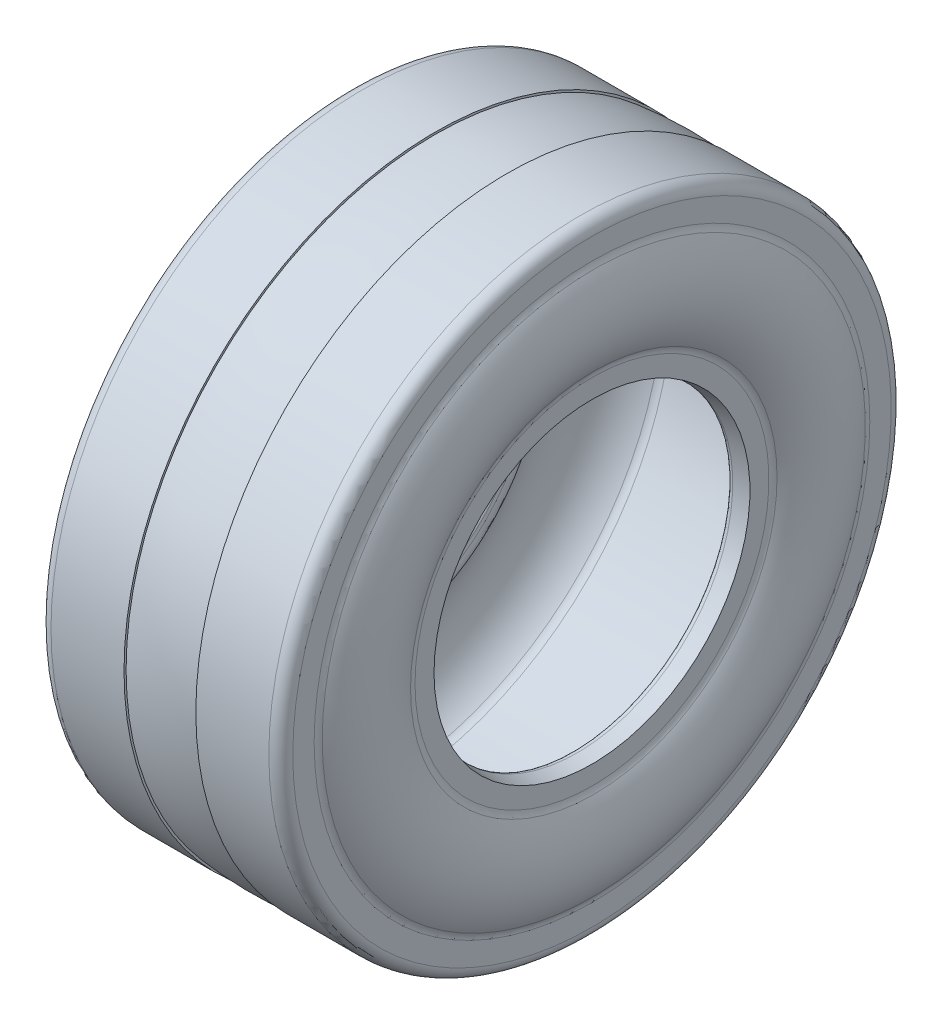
SolidWorks part; units mm, degrees
ref_plane "Plan1" through (0, 0, 0) normal (0, 0, 1) x (1, 0, 0)
ref_plane "Plan2" through (0, 0, 0) normal (0, 1, 0) x (1, 0, 0)
ref_plane "Plan3" through (0, 0, 0) normal (1, 0, 0) x (0, 0, -1)
sketch "Esquisse1" plane through (80, -50, 0) normal (0, 0, 1) x (1, 0, 0)
  line L0 (-67.6459, 20) -> (-37.1459, 20)
  line L1 (-72.6459, -36.0713) -> (-72.6459, -44)
  line L2 (-58.9756, 11) -> (14.6839, 11)
  line L3 (-22.1459, 20) -> (-22.1459, -110) construction
  line L4 (-37.1459, 20) -> (-37.1459, 19.1317)
  line L5 (-64.2279, -43.6079) -> (-63.8552, -42.4206)
  line L6 (28.3541, -44) -> (22.1581, -44.9841)
  line L7 (-80, -110) -> (72.1756, -110) construction
  line L8 (28.3541, 15) -> (28.3541, 6.0713)
  line L9 (19.9362, -43.6079) -> (19.5635, -42.4206)
  line L10 (28.3541, -36.0713) -> (28.3541, -44)
  line L11 (-7.1459, 20) -> (-7.1459, 19.1317)
  line L12 (-7.1459, 20) -> (23.3541, 20)
  line L15 (-72.6459, 15) -> (-72.6459, 6.0713)
  line L16 (-72.6459, -44) -> (-66.4498, -44.9841)
  arc A0 (-61.9236, 10.0385) -> (-65.1562, -37.3227) centre (-43.6459, -15) ccw
  arc A1 (-73.3959, 3.4374) -> (-73.3959, -33.4374) centre (-43.6459, -15) ccw
  arc A2 (-72.6459, -36.0713) -> (-73.3959, -33.4374) centre (-77.6459, -36.0713) ccw
  arc A3 (-73.3959, 3.4374) -> (-72.6459, 6.0713) centre (-77.6459, 6.0713) ccw
  arc A4 (-67.6459, 20) -> (-72.6459, 15) centre (-67.6459, 15) ccw
  arc A5 (14.6839, 11) -> (17.6319, 10.0385) centre (14.6839, 6) cw
  arc A6 (-65.1562, -37.3227) -> (-63.8552, -42.4206) centre (-68.6257, -40.9231) cw
  arc A7 (-64.2279, -43.6079) -> (-66.4498, -44.9841) centre (-66.1361, -43.0089) cw
  arc A8 (-58.9756, 11) -> (-61.9236, 10.0385) centre (-58.9756, 6) ccw
  arc A9 (19.9362, -43.6079) -> (22.1581, -44.9841) centre (21.8444, -43.0089) ccw
  arc A10 (20.8645, -37.3227) -> (19.5635, -42.4206) centre (24.334, -40.9231) ccw
  arc A11 (23.3541, 20) -> (28.3541, 15) centre (23.3541, 15) cw
  arc A12 (29.1041, 3.4374) -> (28.3541, 6.0713) centre (33.3541, 6.0713) cw
  arc A13 (28.3541, -36.0713) -> (29.1041, -33.4374) centre (33.3541, -36.0713) cw
  arc A14 (29.1041, 3.4374) -> (29.1041, -33.4374) centre (-0.6459, -15) cw
  arc A15 (17.6319, 10.0385) -> (20.8645, -37.3227) centre (-0.6459, -15) cw
  arc A16 (-7.1459, 19.1317) -> (-37.1459, 19.1317) centre (-22.1459, -110) ccw
  point P9 (-72.6459, -34.5959)
  point P15 (-72.6459, 20)
  point P20 (-22.1459, 20)
  point P29 (-64.7449, -45.2549)
  point P49 (-22.1459, 11)
  point P50 (-22.1459, 20)
  dimension "D8" = 260
  dimension "D9" = 5
  dimension "D4" = 62
  dimension "D5" = 70
  dimension "D11" = 5
  dimension "D12" = 2
  dimension "D13" = 5
  dimension "D1" = 64
  dimension "D2" = 29
  dimension "D3" = 29
  dimension "D6" = 8
  dimension "D7" = 101
  dimension "D10" = 9
  dimension "D14" = 30
revolve "Base-Révolution" add sketch "Esquisse1" angle 360 about L7
